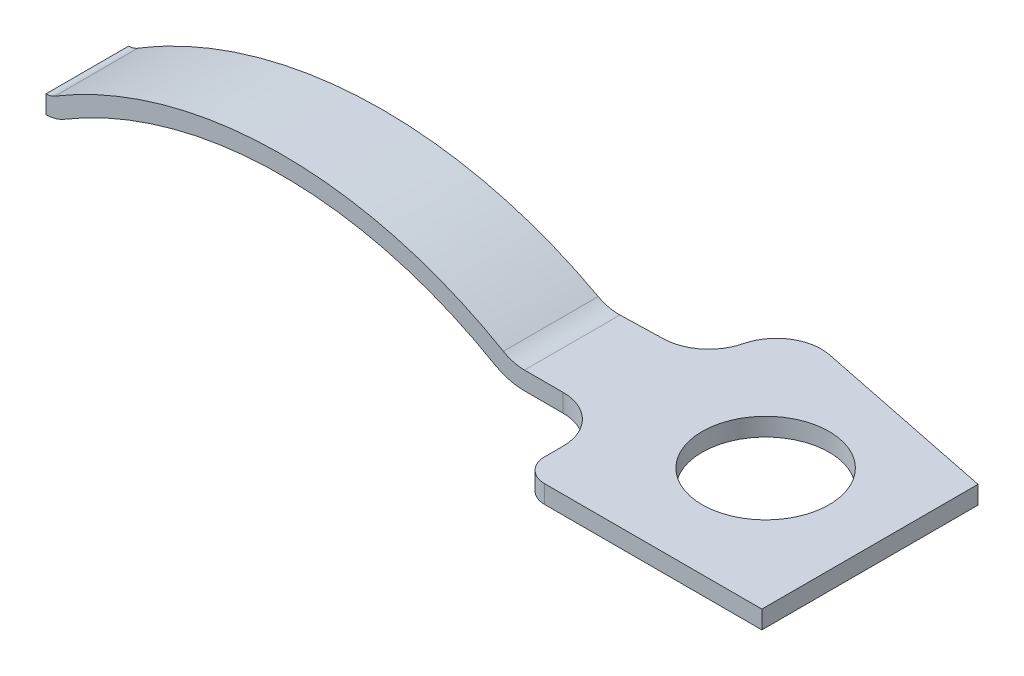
SolidWorks part; units mm, degrees
ref_plane "Front Plane" through (0, 0, 0) normal (0, 0, 1) x (1, 0, 0)
ref_plane "Top Plane" through (0, 0, 0) normal (0, 1, 0) x (1, 0, 0)
ref_plane "Right Plane" through (0, 0, 0) normal (1, 0, 0) x (0, 0, -1)
sketch "Sketch1" plane through (0, 0, 0) normal (0, 0, 1) x (1, 0, 0)
  line L0 (0, 16.3339) -> (0, 0) construction
  line L1 (0, 0) -> (-23.114, 0) construction
  line L2 (-23.114, 0) -> (-23.114, 8.1669) construction
  line L4 (0, 2.2098) -> (-23.114, 2.2098) construction
  line L5 (-6.9428, 0) -> (4.064, 0)
  line L10 (0, 0) -> (-23.114, 0) construction
  line L12 (-6.9428, 0.6096) -> (4.064, 0.6096)
  line L13 (-23.114, 0.6096) -> (-23.114, 0)
  line L14 (4.064, 0.6096) -> (4.064, 0)
  arc A0 (-23.114, 0) -> (-22.4993, 0.1704) centre (-23.114, 1.1938) ccw
  arc A1 (-7.9638, 0.2752) -> (-22.4993, 0.1704) centre (-15.1429, -12.0777) ccw
  arc A2 (-7.9638, 0.2752) -> (-6.9428, 0) centre (-6.9428, 2.032) ccw
  arc A3 (-23.114, 0.6096) -> (-22.8132, 0.693) centre (-23.114, 1.1938) ccw
  arc A4 (-7.6575, 0.8022) -> (-22.8132, 0.693) centre (-15.1429, -12.0777) ccw
  arc A5 (-7.6575, 0.8022) -> (-6.9428, 0.6096) centre (-6.9428, 2.032) ccw
  point P3 (0, 0)
  point P16 (0, 0)
  point P17 (0, 0)
  dimension "D3" = 1.1938
  dimension "D4" = 14.2875
  dimension "D5" = 4.064
  dimension "D8" = 2.032
  dimension "D1" = 23.114
  dimension "D6" = 2.2098
  dimension "D9" = 0.6096
extrude "Boss-Extrude3" add sketch "Sketch1" along normal blind 4.191 and the other way blind 4.572
sketch "Sketch6" plane through (0, 0.6096, 0) normal (0, 1, 0) x (1, 0, 0)
  line L0 (-23.114, 0.1905) -> (4.064, 0.1905) construction
  line L1 (-23.114, -4.191) -> (-23.114, 4.572) construction
  line L2 (4.064, -4.191) -> (4.064, 4.572) construction
  line L3 (4.064, -4.191) -> (-6.9428, -4.191) construction
  line L4 (-4.064, 2.9014) -> (-4.064, 2.0955)
  line L6 (-4.064, -1.2065) -> (-23.114, -1.2065)
  line L7 (-23.114, 1.5875) -> (-4.064, 2.0955)
  line L8 (-4.064, -1.2065) -> (-4.064, -4.445)
  line L9 (-23.114, 1.5875) -> (-23.114, -1.2065)
  line L10 (-4.064, -4.445) -> (-23.622, -4.445)
  line L11 (-23.622, -4.445) -> (-23.622, 5.334)
  line L12 (-23.622, 5.334) -> (4.064, 5.334)
  line L13 (-22.8132, -4.191) -> (-7.6575, -4.191) construction
  line L14 (-7.6575, 4.572) -> (-22.8132, 4.572) construction
  line L15 (0, 0) -> (-11.0853, 2.2553) construction
  line L16 (4.064, 3.1131) -> (-2.2362, 4.3948)
  line L17 (4.064, 3.1131) -> (4.064, 5.334)
  line L18 (0.7697, 3.7833) -> (-10.3156, 6.0386) construction
  circle A0 centre (0, 0) radius 2.1463
  arc A1 (-2.2362, 4.3948) -> (-4.064, 2.9014) centre (-2.54, 2.9014) ccw
  point P31 (-6.1069, 4.445)
  point P32 (4.064, 4.953)
  point P33 (4.064, 4.6995)
  dimension "D1" = 4.2926
  dimension "D12" = 1.524
  dimension "D2" = 4.3815
  dimension "D3" = 4.064
  dimension "D4" = 1.397
  dimension "D5" = 3.302
  dimension "D6" = 2.794
  dimension "D7" = 0.254
  dimension "D8" = 0.762
  dimension "D9" = 0.508
  dimension "D10" = 11.5
  dimension "D11" = 3.8608
extrude "Cut-Extrude4" cut sketch "Sketch6" against normal through all both and the other way through all
fillet "Fillet1" radius 1.5748 2 edges at (-4.064, 0.3048, -2.0955) (-4.064, 0.3048, 1.2065)
fillet "Fillet2" radius 0.7874 1 edges at (-4.064, 0.3048, 4.191)
